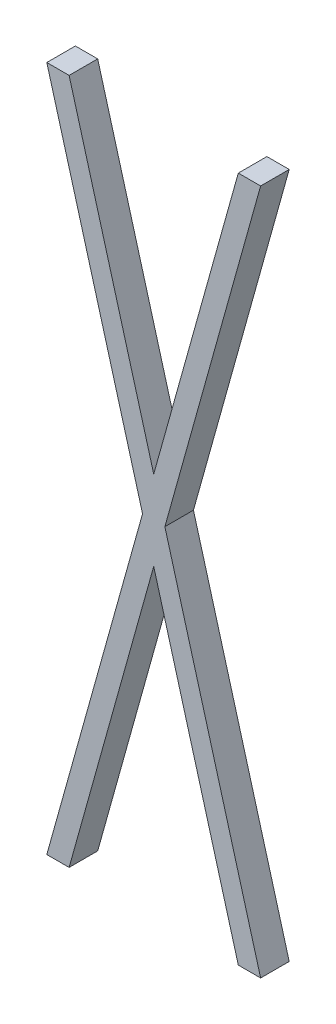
SolidWorks part; units mm, degrees
ref_plane "Front Plane" through (0, 0, 0) normal (0, 0, 1) x (1, 0, 0)
ref_plane "Top Plane" through (0, 0, 0) normal (0, 1, 0) x (1, 0, 0)
ref_plane "Right Plane" through (0, 0, 0) normal (1, 0, 0) x (0, 0, -1)
sketch "Sketch1" plane through (0, 0, 0) normal (0, 0, 1) x (1, 0, 0)
  line L0 (1.5411, -8.0599) -> (-9.0964, -46.1599)
  line L1 (-6.6175, 30.0401) -> (2.7805, -3.6206)
  line L2 (14.6574, -46.1599) -> (12.1785, -46.1599)
  line L3 (12.1785, -46.1599) -> (2.7805, -12.4991)
  line L4 (-9.0964, 30.0401) -> (-6.6175, 30.0401)
  line L5 (2.7805, -11.0907) -> (2.7805, 0) construction
  line L6 (12.1785, 30.0401) -> (2.7805, -3.6206)
  line L7 (-9.0964, -46.1599) -> (-6.6175, -46.1599)
  line L8 (14.6574, 30.0401) -> (12.1785, 30.0401)
  line L9 (-6.6175, -46.1599) -> (2.7805, -12.4991)
  line L10 (4.0199, -8.0599) -> (14.6574, -46.1599)
  line L11 (4.0199, -8.0599) -> (14.6574, 30.0401)
  line L12 (1.5411, -8.0599) -> (-9.0964, 30.0401)
  dimension "D1" = 38.1
  dimension "D2" = 38.1
  dimension "D3" = 9.398
extrude "Extrude1" add sketch "Sketch1" along normal blind 3.175
